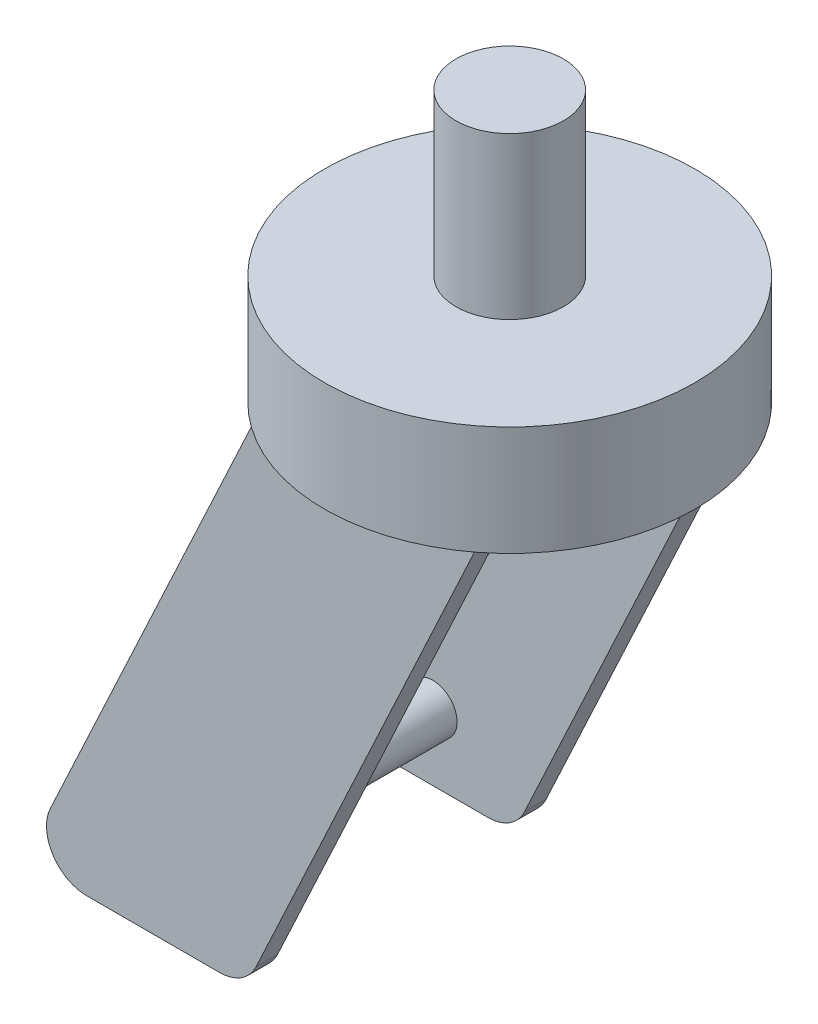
SolidWorks part; units mm, degrees
ref_plane "Piano frontale" through (0, 0, 0) normal (0, 0, 1) x (1, 0, 0)
ref_plane "Piano superiore" through (0, 0, 0) normal (0, 1, 0) x (1, 0, 0)
ref_plane "Piano destro" through (0, 0, 0) normal (1, 0, 0) x (0, 0, -1)
sketch "Schizzo1" plane through (0, 0, 0) normal (0, 0, 1) x (1, 0, 0)
  line L0 (0, -2388.8761) -> (0, 117054.929) construction
  line L1 (0, 0) -> (0, 109.8)
  line L2 (0, 109.8) -> (20, 109.8)
  line L3 (20, 109.8) -> (20, 49.8)
  line L4 (20, 49.8) -> (69, 49.8)
  line L5 (69, 49.8) -> (69, 9)
  line L6 (69, 9) -> (51.41, 9)
  line L7 (51.41, 9) -> (51.41, 0)
  line L8 (51.41, 0) -> (0, 0)
  dimension "D1" = 20
  dimension "D2" = 60
  dimension "D3" = 69
  dimension "D4" = 40.8
  dimension "D5" = 9
  dimension "D6" = 51.41
revolve "Rivoluzione1" add sketch "Schizzo1" angle 360 about L0
sketch "Schizzo2" plane through (0, 9, 0) normal (0, -1, 0) x (1, 0, 0)
  line L0 (0, 50) -> (-41.3, 50) construction
  line L1 (-41.3, 54) -> (41.3, 54)
  line L2 (-41.3, 54) -> (-41.3, 46)
  line L3 (-41.3, 46) -> (41.3, 46)
  line L4 (41.3, 54) -> (41.3, 46)
  line L5 (-41.3, 54) -> (41.3, 46) construction
  line L6 (-41.3, 46) -> (41.3, 54) construction
  line L7 (0, 50) -> (0, 54) construction
  point P0 (0, 50)
  dimension "D1" = 82.6
  dimension "D2" = 54
  dimension "D3" = 8
sketch3d "Schizzo3D1"
  line L0 (0.0013, 9.0028, 50) -> (-16.0628, -25.4467, 50) construction
  line L3 (0, 9, 50) -> (-41.3, 9, 50) construction
  line L6 (0, 9, 50) -> (0, 9, 54) construction
  dimension "D1" = 65
  dimension "D2" = 90
ref_plane "Piano2" through (0, 0, 50) normal (0, 0, 1) x (1, 0, 0)
sketch "Schizzo4" plane through (0, 0, 50) normal (0, 0, 1) x (1, 0, 0)
  line L0 (-41.3, 9) -> (41.2989, 9)
  line L1 (-41.3, 9) -> (41.3, 9) construction
  line L2 (-41.3, 9) -> (41.3, 9) construction
  line L3 (-69, 9) -> (69, 9) construction
  line L4 (41.2989, 9) -> (-40.4632, -166.3393)
  line L5 (-54.0578, -175) -> (-103.5553, -175)
  line L6 (-117.1499, -153.6607) -> (-41.3, 9)
  line L7 (-51.41, 0) -> (51.41, 0) construction
  line L8 (51.41, 0) -> (51.41, 9) construction
  circle A0 centre (-74.59, -150) radius 9 construction
  arc A1 (-103.5553, -175) -> (-117.1499, -153.6607) centre (-103.5553, -160) cw
  arc A2 (-40.4632, -166.3393) -> (-54.0578, -175) centre (-54.0578, -160) cw
  dimension "D4" = 18
  dimension "D7" = 15
  dimension "D8" = 15
  dimension "D1" = 65
  dimension "D2" = 74.86
  dimension "D3" = 184
  dimension "D5" = 25
  dimension "D6" = 126
extrude "Estrusione-Estrusione2" add sketch "Schizzo4" against normal mid plane 8
mirror "Specchia1" about plane through (0, 0, 0) normal (0, 0, 1) of "Estrusione-Estrusione2"
sketch "Schizzo6" plane through (0, 0, 54) normal (0, 0, 1) x (1, 0, 0)
  line L0 (-103.5553, -175) -> (-54.0578, -175) construction
  line L2 (51.41, 0) -> (51.41, 9) construction
  circle A0 centre (-74.59, -150) radius 9
  dimension "D1" = 18
  dimension "D2" = 25
  dimension "D3" = 126
extrude "Estrusione-Estrusione3" add sketch "Schizzo6" along normal up to surface (92 mm away) from surface contours A0
sketch "Schizzo7" plane through (0, 0, 0) normal (0, 0, 1) x (1, 0, 0)
  line L0 (0, -109.8) -> (0, 109.8) construction
  line L1 (20, 109.8) -> (-20, 109.8) construction
  point P6 (0, 0)
